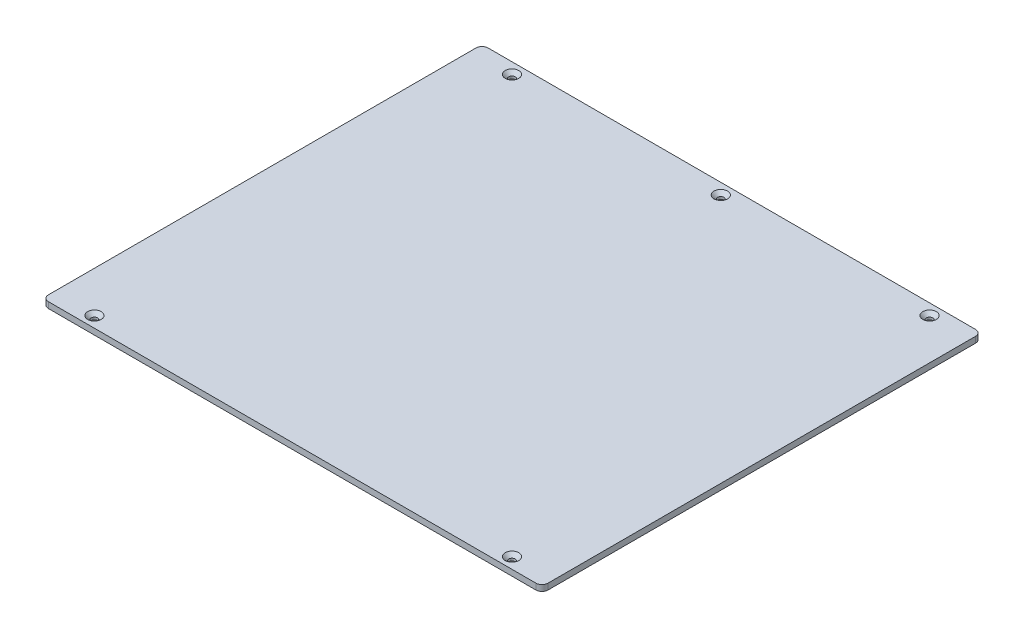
SolidWorks part; units mm, degrees
ref_plane "Alzado" through (0, 0, 0) normal (0, 0, 1) x (1, 0, 0)
ref_plane "Planta" through (0, 0, 0) normal (0, 1, 0) x (1, 0, 0)
ref_plane "Vista lateral" through (0, 0, 0) normal (1, 0, 0) x (0, 0, -1)
sketch "Croquis1" plane through (0, 0, 0) normal (0, 1, 0) x (1, 0, 0)
  line L0 (0, 167.2443) -> (0, 0) construction
  line L2 (-125, -110) -> (125, -110)
  line L3 (-125, -110) -> (-125, 110)
  line L4 (-125, 110) -> (125, 110)
  line L5 (0, 0) -> (277.7522, 0) construction
  line L6 (125, -110) -> (125, 110)
  line L7 (-125, -110) -> (125, 110) construction
  line L8 (-125, 110) -> (125, -110) construction
  circle A0 centre (104.5, 104.5) radius 1.6
  circle A1 centre (-104.5, 104.5) radius 1.6
  circle A2 centre (104.5, -104.5) radius 1.6
  circle A3 centre (-104.5, -104.5) radius 1.6
  circle A4 centre (0, 104.5) radius 1.6
  dimension "D2" = 209
  dimension "D3" = 3.2
  dimension "D4" = 209
  dimension "D5" = 250
  dimension "D1" = 220
extrude "Saliente-Extruir2" add sketch "Croquis1" along normal blind 3
chamfer "Фаска1" distance 1.8 angle 45 5 edges at (-104.5, 3, 106.1) (104.5, 3, 102.9) (-104.5, 3, -106.1) (104.5, 3, -102.9) (0, 3, -102.9)
fillet "Скругление1" radius 3 4 edges at (125, 1.5, 110) (-125, 1.5, 110) (-125, 1.5, -110) (125, 1.5, -110)
